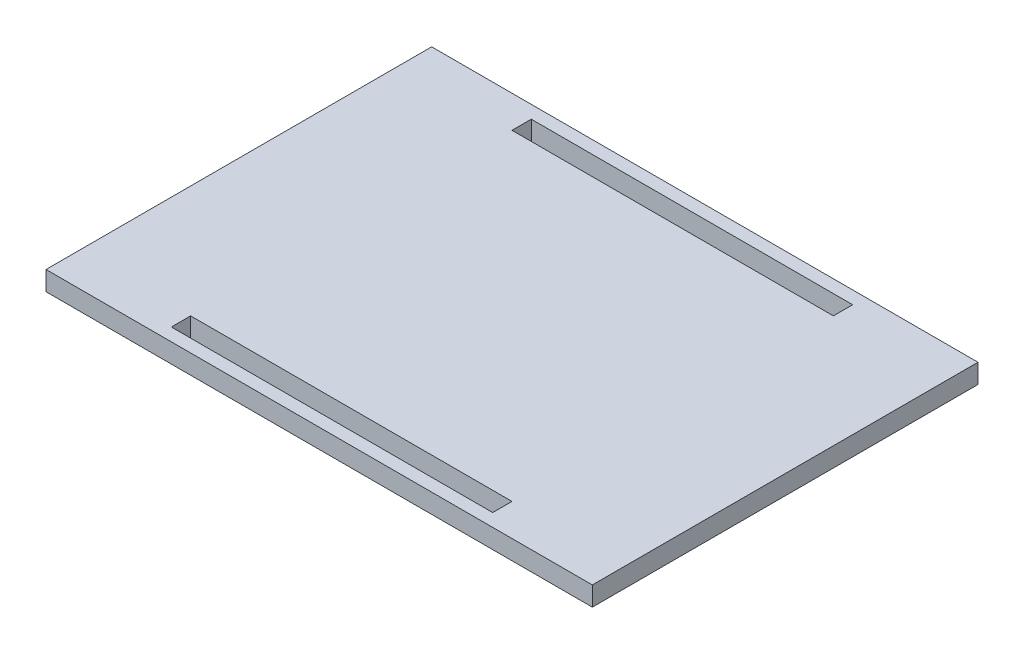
SolidWorks part; units mm, degrees
ref_plane "Front Plane" through (0, 0, 0) normal (0, 0, 1) x (1, 0, 0)
ref_plane "Top Plane" through (0, 0, 0) normal (0, 1, 0) x (1, 0, 0)
ref_plane "Right Plane" through (0, 0, 0) normal (1, 0, 0) x (0, 0, -1)
sketch "Sketch1" plane through (0, 0, 0) normal (0, 1, 0) x (1, 0, 0)
  line L1 (-42.5, 30) -> (42.5, 30)
  line L2 (-42.5, 30) -> (-42.5, -30)
  line L3 (-42.5, -30) -> (42.5, -30)
  line L4 (42.5, 30) -> (42.5, -30)
  line L5 (-42.5, 30) -> (42.5, -30) construction
  line L6 (-42.5, -30) -> (42.5, 30) construction
  line L7 (-25, 28) -> (25, 28)
  line L8 (-25, 28) -> (-25, 25)
  line L9 (-25, 25) -> (25, 25)
  line L10 (25, 28) -> (25, 25)
  line L11 (-25, 28) -> (25, 25) construction
  line L12 (-25, 25) -> (25, 28) construction
  line L13 (-25, -25) -> (25, -25)
  line L14 (-25, -25) -> (-25, -28)
  line L15 (-25, -28) -> (25, -28)
  line L16 (25, -25) -> (25, -28)
  line L17 (-25, -25) -> (25, -28) construction
  line L18 (-25, -28) -> (25, -25) construction
  point P0 (0, 0)
  point P6 (0, 26.5)
  point P11 (0, -26.5)
  dimension "D1" = 85
  dimension "D2" = 60
  dimension "D3" = 50
  dimension "D4" = 26.5
  dimension "D5" = 26.5
  dimension "D6" = 3
extrude "Boss-Extrude1" add sketch "Sketch1" along normal blind 3
